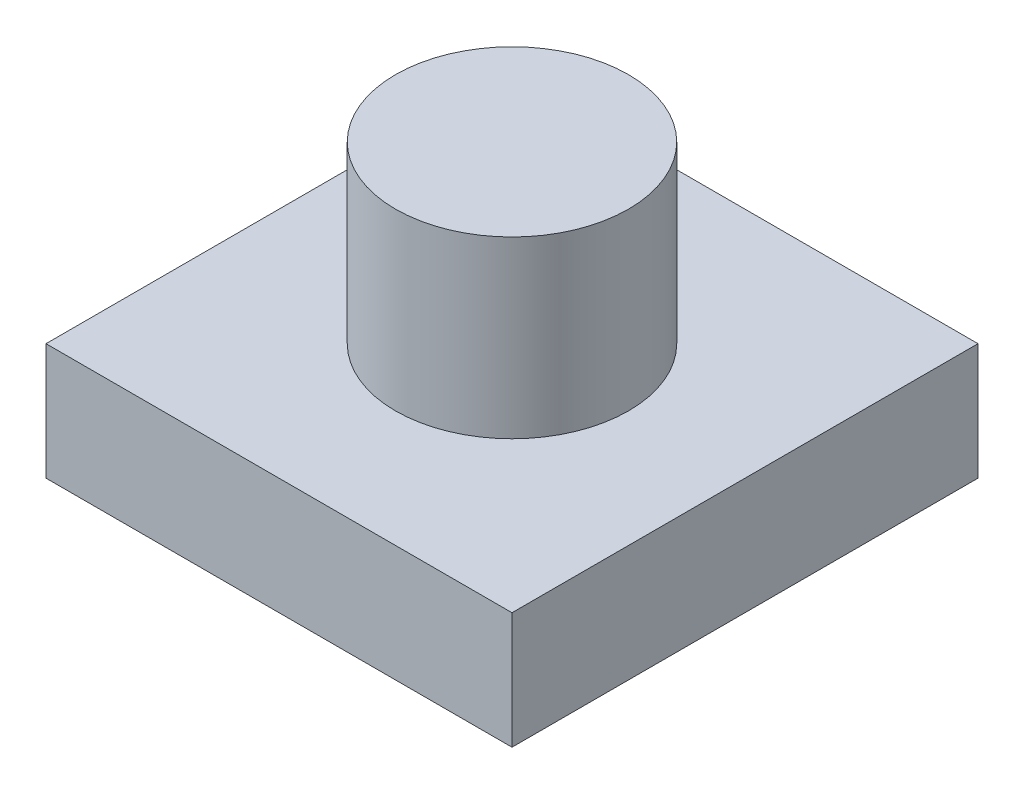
SolidWorks part; units mm, degrees
ref_plane "Front Plane" through (0, 0, 0) normal (0, 0, 1) x (1, 0, 0)
ref_plane "Top Plane" through (0, 0, 0) normal (0, 1, 0) x (1, 0, 0)
ref_plane "Right Plane" through (0, 0, 0) normal (1, 0, 0) x (0, 0, -1)
sketch "Sketch1" plane through (0, 0, 0) normal (0, 1, 0) x (1, 0, 0)
  line L1 (-6.35, -6.35) -> (6.35, -6.35)
  line L2 (-6.35, -6.35) -> (-6.35, 6.35)
  line L3 (-6.35, 6.35) -> (6.35, 6.35)
  line L4 (6.35, -6.35) -> (6.35, 6.35)
  line L5 (-6.35, -6.35) -> (6.35, 6.35) construction
  line L6 (-6.35, 6.35) -> (6.35, -6.35) construction
  point P0 (0, 0)
  dimension "D1" = 12.7
  dimension "D2" = 12.7
extrude "Boss-Extrude1" add sketch "Sketch1" along normal blind 3.175
sketch "Sketch2" plane through (0, 3.175, 0) normal (0, 1, 0) x (1, 0, 0)
  line L0 (-6.35, 6.35) -> (-6.35, -6.35) construction
  line L1 (6.35, 6.35) -> (-6.35, 6.35) construction
  circle A0 centre (0, 0) radius 3.175
  dimension ".25" = 6.35
  dimension "D2" = 6.35
  dimension "D3" = 6.35
extrude "Boss-Extrude2" add sketch "Sketch2" along normal blind 4.7625
